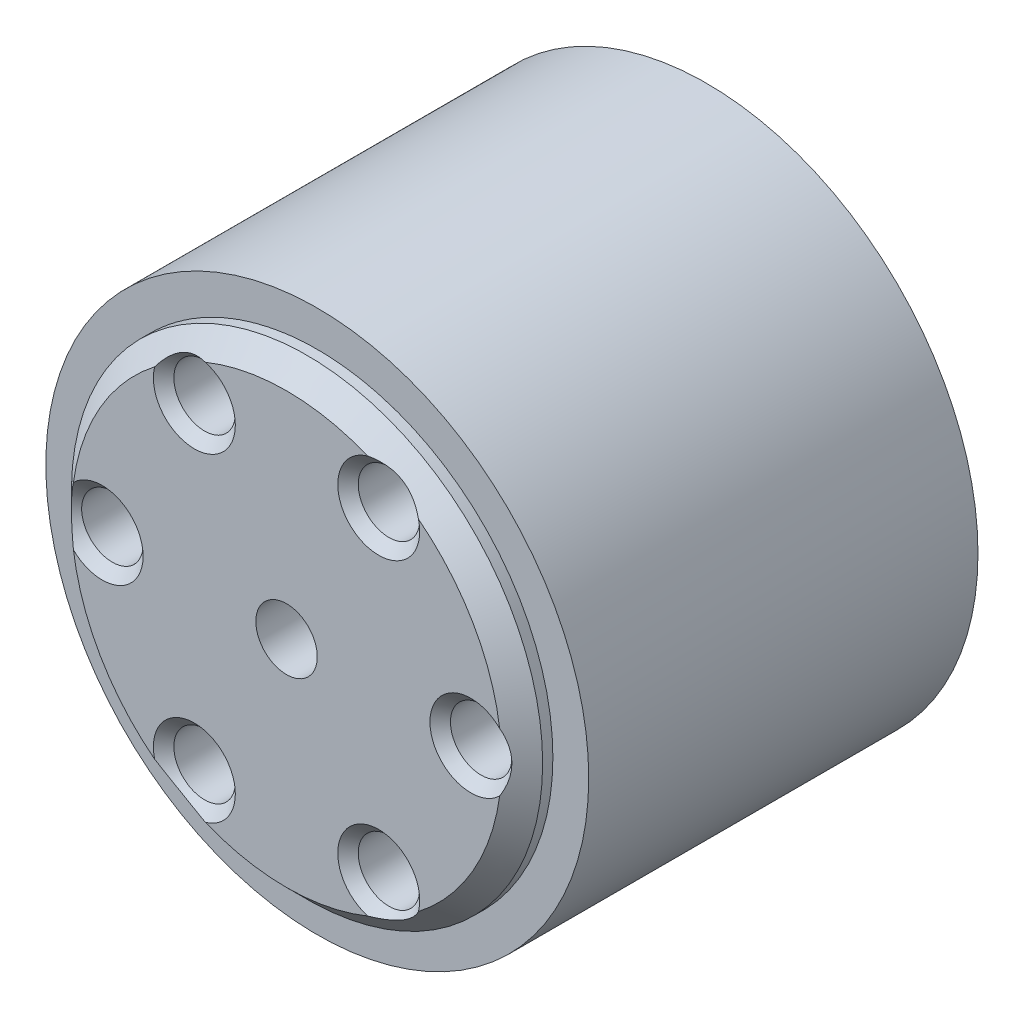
SolidWorks part; units mm, degrees
ref_plane "Front Plane" through (0, 0, 0) normal (0, 0, 1) x (1, 0, 0)
ref_plane "Top Plane" through (0, 0, 0) normal (0, 1, 0) x (1, 0, 0)
ref_plane "Right Plane" through (0, 0, 0) normal (1, 0, 0) x (0, 0, -1)
sketch "Sketch1" plane through (0, 0, 0) normal (0, 0, 1) x (1, 0, 0)
  circle A0 centre (0, 0) radius 11.5
  dimension "D1" = 23
extrude "Boss-Extrude1" add sketch "Sketch1" along normal mid plane 22
chamfer "Chamfer1" distance 1 angle 45 2 edges at (11.5, 0, -11) (11.5, 0, 11)
sketch "Sketch2" plane through (0, 0, -11) normal (0, 0, -1) x (-1, 0, 0)
  circle A0 centre (0, 0) radius 9
  dimension "D1" = 18
extrude "Cut-Extrude1" cut sketch "Sketch2" against normal blind 14.5
sketch "Sketch3" plane through (0, 0, 3.5) normal (0, 0, -1) x (-1, 0, 0)
  circle A0 centre (0, 0) radius 1.5
  dimension "D1" = 3
extrude "Cut-Extrude2" cut sketch "Sketch3" against normal through all
sketch "Sketch4" plane through (0, 0, 11) normal (0, 0, 1) x (1, 0, 0)
  line L0 (0, 0) -> (9, 0) construction
  line L1 (0, 0) -> (4.5, -7.7942) construction
  line L2 (0, 0) -> (-4.5, -7.7942) construction
  line L3 (0, 0) -> (-9, 0) construction
  line L4 (0, 0) -> (-4.5, 7.7942) construction
  line L5 (0, 0) -> (4.5, 7.7942) construction
  circle A0 centre (9, 0) radius 1.5
  circle A1 centre (4.5, -7.7942) radius 1.5
  circle A2 centre (-4.5, -7.7942) radius 1.5
  circle A3 centre (-9, 0) radius 1.5
  circle A4 centre (-4.5, 7.7942) radius 1.5
  circle A5 centre (4.5, 7.7942) radius 1.5
  point P16 (0, 0)
  dimension "D1" = 3
  dimension "D2" = 9
  dimension "D3" = 6
extrude "Cut-Extrude3" cut sketch "Sketch4" against normal up to surface (7.5 mm away)
chamfer "Chamfer2" distance 0.5 angle 45 7 edges at (6, 7.7942, 11) (3.75, 6.4952, 3.5) (10.5, 0, 11) (6, -7.7942, 11) (-3, -7.7942, 11) (-7.5, 0, 11) (-3, 7.7942, 11)
sketch "Sketch5" plane through (0, 0, 0) normal (0, 0, 1) x (1, 0, 0)
  circle A0 centre (0, 0) radius 13.25
  circle A1 centre (0, 0) radius 11.5
  circle A2 centre (0, 0) radius 11.5 construction
  dimension "D1" = 26.5
extrude "Boss-Extrude2" add sketch "Sketch5" along normal mid plane 19 separate body
